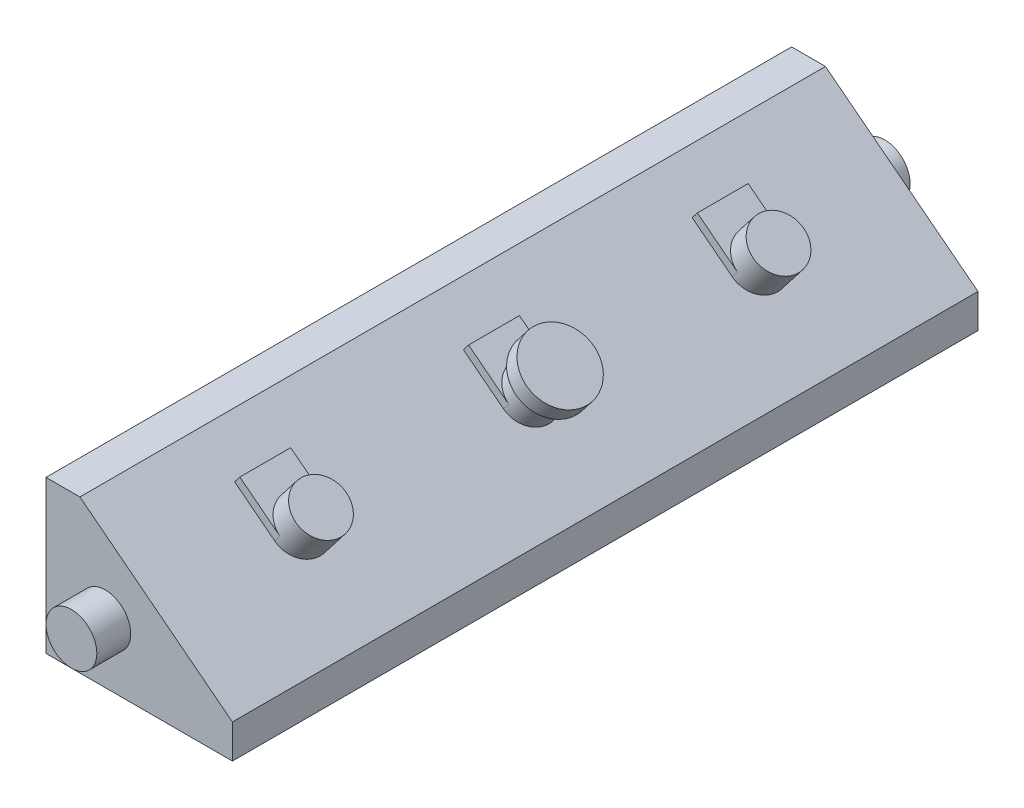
SolidWorks part; units mm, degrees
ref_plane "前视基准面" through (0, 0, 0) normal (0, 0, 1) x (1, 0, 0)
ref_plane "上视基准面" through (0, 0, 0) normal (0, 1, 0) x (1, 0, 0)
ref_plane "右视基准面" through (0, 0, 0) normal (1, 0, 0) x (0, 0, -1)
sketch "草图1" plane through (0, 0, 0) normal (0, 0, 1) x (1, 0, 0)
  line L0 (0, 0) -> (0, -90)
  line L1 (0, -90) -> (110, -90)
  line L2 (0, 0) -> (20, 0)
  line L3 (110, -90) -> (110, -70)
  line L4 (20, 0) -> (110, -70)
extrude "凸台-拉伸1" add sketch "草图1" along normal blind 440
sketch "草图2" plane through (7.5385, 9.6923, 0) normal (0.6139, 0.7894, 0) x (0.7894, -0.6139, 0)
  line L0 (15.787, -220) -> (129.8046, -220) construction
  line L1 (15.787, -440) -> (15.787, 0) construction
  line L2 (129.8046, -440) -> (129.8046, 0) construction
  line L3 (72.7958, -220) -> (72.7958, -85) construction
  line L4 (72.7958, -100) -> (42.7958, -100)
  line L5 (72.7958, -70) -> (42.7958, -70)
  line L6 (42.7958, -100) -> (42.7958, -70)
  line L7 (72.7958, -370) -> (42.7958, -370)
  line L8 (72.7958, -340) -> (42.7958, -340)
  line L9 (42.7958, -340) -> (42.7958, -370)
  line L10 (72.7958, -152.5) -> (107.3067, -152.5) construction
  line L11 (72.7958, -235) -> (42.7958, -235)
  line L12 (42.7958, -205) -> (42.7958, -235)
  line L13 (72.7958, -205) -> (42.7958, -205)
  arc A0 (72.7958, -100) -> (72.7958, -70) centre (72.7958, -85) ccw
  arc A1 (72.7958, -340) -> (72.7958, -370) centre (72.7958, -355) cw
  arc A2 (72.7958, -205) -> (72.7958, -235) centre (72.7958, -220) cw
extrude "凸台-拉伸2" add sketch "草图2" along normal blind 5
sketch "草图3" plane through (10.6082, 13.6391, 0) normal (0.6139, 0.7894, 0) x (0.7894, -0.6139, 0)
  circle A0 centre (72.7958, -355) radius 15
  circle A1 centre (72.7958, -220) radius 15
  circle A2 centre (72.7958, -85) radius 15
extrude "凸台-拉伸3" add sketch "草图3" along normal blind 15
sketch "草图4" plane through (19.8173, 25.4794, 0) normal (0.6139, 0.7894, 0) x (0.7894, -0.6139, 0)
  circle A0 centre (72.7958, -220) radius 20
extrude "凸台-拉伸4" add sketch "草图4" along normal blind 10
sketch "草图5" plane through (0, 0, 440) normal (0, 0, 1) x (1, 0, 0)
  line L0 (0, 0) -> (0, -90) construction
  line L1 (0, -90) -> (110, -90) construction
  circle A0 centre (35, -55) radius 15
  dimension "D1" = 35
  dimension "D2" = 35
extrude "凸台-拉伸5" add sketch "草图5" along normal blind 20
sketch "草图6" plane through (0, 0, 0) normal (0, 0, -1) x (-1, 0, 0)
  line L0 (0, 0) -> (0, -90) construction
  line L1 (0, -90) -> (-110, -90) construction
  circle A0 centre (-35, -55) radius 15
  dimension "D1" = 35
  dimension "D2" = 35
extrude "凸台-拉伸6" add sketch "草图6" along normal blind 20
